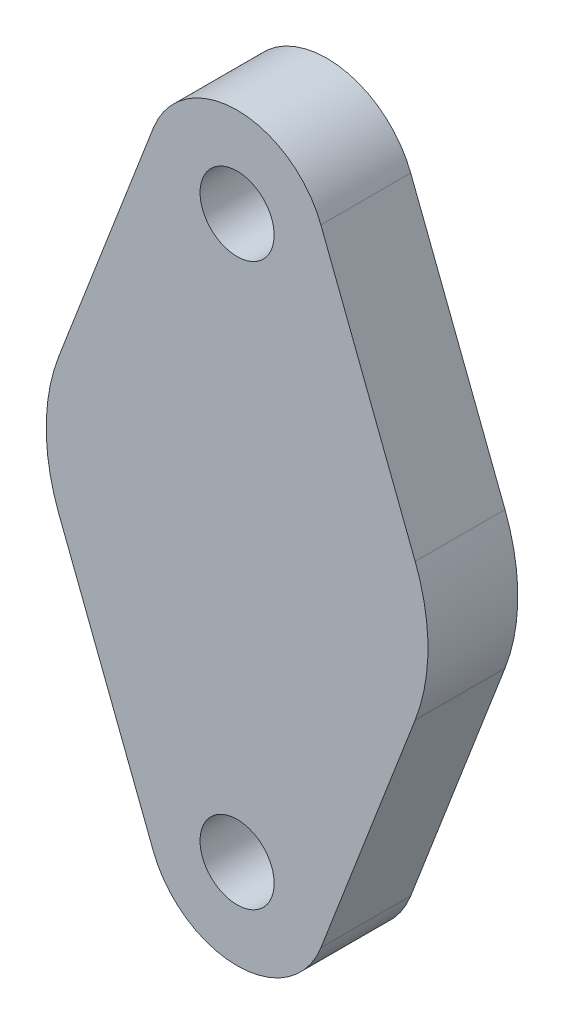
SolidWorks part; units mm, degrees
ref_plane "Спереди" through (0, 0, 0) normal (0, 0, 1) x (1, 0, 0)
ref_plane "Сверху" through (0, 0, 0) normal (0, 1, 0) x (1, 0, 0)
ref_plane "Справа" through (0, 0, 0) normal (1, 0, 0) x (0, 0, -1)
sketch "Эскиз1" plane through (0, 0, 0) normal (0, 0, 1) x (1, 0, 0)
  line L0 (7.9301, 3.0601) -> (3.7316, 13.9402)
  line L1 (-7.9301, 3.0601) -> (-3.7316, 13.9402)
  line L2 (-7.9301, -3.0601) -> (-3.7316, -13.9402)
  line L3 (7.9301, -3.0601) -> (3.7316, -13.9402)
  line L4 (0, 17.7503) -> (0, 0) construction
  line L5 (0, 0) -> (13.6473, 0) construction
  arc A0 (-7.9301, -3.0601) -> (-7.9301, 3.0601) centre (0, 0) cw
  arc A1 (3.7316, 13.9402) -> (-3.7316, 13.9402) centre (0, 12.5002) ccw
  circle A2 centre (0, -12.5002) radius 1.65
  arc A3 (3.7316, -13.9402) -> (-3.7316, -13.9402) centre (0, -12.5002) cw
  arc A4 (7.9301, -3.0601) -> (7.9301, 3.0601) centre (0, 0) ccw
  circle A5 centre (0, 12.5002) radius 1.65
  dimension "D1" = 25.0004
  dimension "D2" = 8.5
  dimension "D3" = 3.9998
  dimension "D4" = 3.3
extrude "Бобышка-Вытянуть1" add sketch "Эскиз1" against normal blind 4
sketch "Эскиз2" plane through (0, 0, -4) normal (0, 0, -1) x (-1, 0, 0)
  circle A0 centre (0, 0) radius 6
  dimension "D1" = 12
extrude "Вырез-Вытянуть1" cut sketch "Эскиз2" against normal blind 2
chamfer "Фаска1" distance 2 angle 45 1 edges at (-6, 0, -4)
